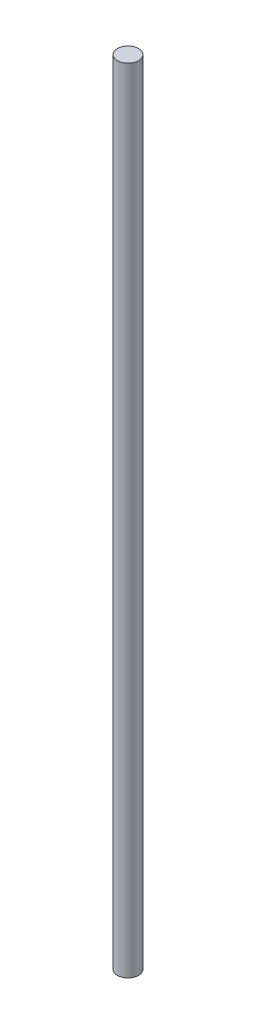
SolidWorks part; units mm, degrees
ref_plane "Alzado" through (0, 0, 0) normal (0, 0, 1) x (1, 0, 0)
ref_plane "Planta" through (0, 0, 0) normal (0, 1, 0) x (1, 0, 0)
ref_plane "Vista lateral" through (0, 0, 0) normal (1, 0, 0) x (0, 0, -1)
sketch "Croquis1" plane through (0, 0, 0) normal (0, 0, 1) x (1, 0, 0)
  line L1 (0, 0) -> (4, 0)
  line L2 (0, 0) -> (0, 300)
  line L3 (0, 300) -> (4, 300)
  line L4 (4, 0) -> (4, 300)
  dimension "D1" = 300
  dimension "D2" = 4
revolve "Revolución1" add sketch "Croquis1" angle 360 about L2
